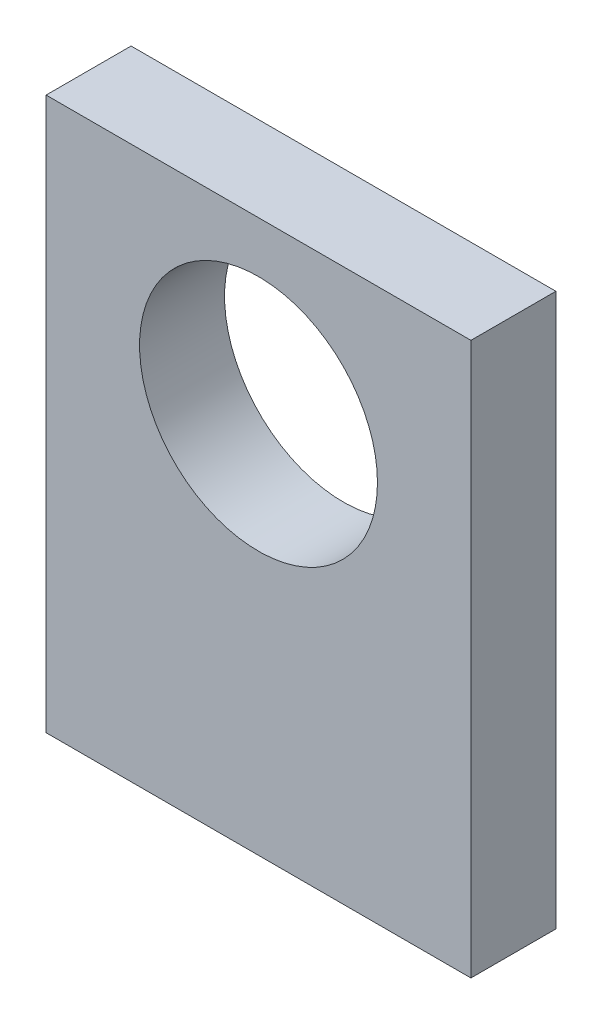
SolidWorks part; units mm, degrees
ref_plane "Спереди" through (0, 0, 0) normal (0, 0, 1) x (1, 0, 0)
ref_plane "Сверху" through (0, 0, 0) normal (0, 1, 0) x (1, 0, 0)
ref_plane "Справа" through (0, 0, 0) normal (1, 0, 0) x (0, 0, -1)
sketch "Эскиз4" plane through (0, 0, 0) normal (0, 0, 1) x (1, 0, 0)
  line L1 (25, 32.5) -> (-25, 32.5)
  line L2 (25, 32.5) -> (25, -32.5)
  line L3 (25, -32.5) -> (-25, -32.5)
  line L4 (-25, 32.5) -> (-25, -32.5)
  line L5 (25, 32.5) -> (-25, -32.5) construction
  line L6 (25, -32.5) -> (-25, 32.5) construction
  point P0 (0, 0)
  dimension "D1" = 50
  dimension "D2" = 65
extrude "Бобышка-Вытянуть2" add sketch "Эскиз4" along normal blind 10
hole_wizard "Диаметр отверстия Ø28.0 (28)1" positions "Эскиз5" profile "Эскиз6" hole size "Ø28.0" standard "DIN"
sketch "Эскиз5" plane through (0, 0, 10) normal (0, 0, 1) x (1, 0, 0)
  line L0 (-25, -32.5) -> (25, -32.5) construction
  point P0 (0, 12.5)
  point P3 (0, 0)
  dimension "D1" = 45
sketch "Эскиз6" plane through (0, 12.5, 10) normal (1, 0, 0) x (0, -1, 0)
  line L0 (0, 0) -> (0, 18.412)
  line L1 (0, 18.412) -> (14, 10)
  line L2 (14, 10) -> (14, 0)
  line L5 (14, 0) -> (0, 0)
  line L10 (0, 18.412) -> (-14, 10) construction
  line L11 (0, -6.35) -> (0, 107.95) construction
  dimension "Диаметр отверстия" = 28
  dimension "Глубина отверстия" = 10
  dimension "Угол заточки сверла" = 118
hole_wizard "Отверстие обработанное метчиком M51" positions "Эскиз7" profile "Эскиз8" tap size "M5" standard "DIN"
sketch "Эскиз7" plane through (0, -32.5, 0) normal (0, -1, 0) x (-1, 0, 0)
  line L0 (25, -10) -> (-25, -10) construction
  point P0 (20.75, -5)
  point P2 (-20.75, -5)
  point P11 (17.0009, -5.4467)
  point P12 (0, 0)
  point P13 (0, 0)
  dimension "D1" = 5
  dimension "D2" = 41.5
  dimension "D3" = 20.75
sketch "Эскиз8" plane through (-20.75, -32.5, 5) normal (1, 0, 0) x (0, 0, -1)
  line L0 (0, 0) -> (0, 15.2618)
  line L1 (0, 15.2618) -> (2.1, 14)
  line L2 (2.1, 14) -> (2.1, 0)
  line L5 (2.1, 0) -> (0, 0)
  line L10 (0, 15.2618) -> (-2.1, 14) construction
  line L11 (0, -6.35) -> (0, 107.95) construction
  dimension "Диаметр сверла" = 4.2
  dimension "Глубина сверла" = 14
  dimension "Угол заточки сверла" = 118
